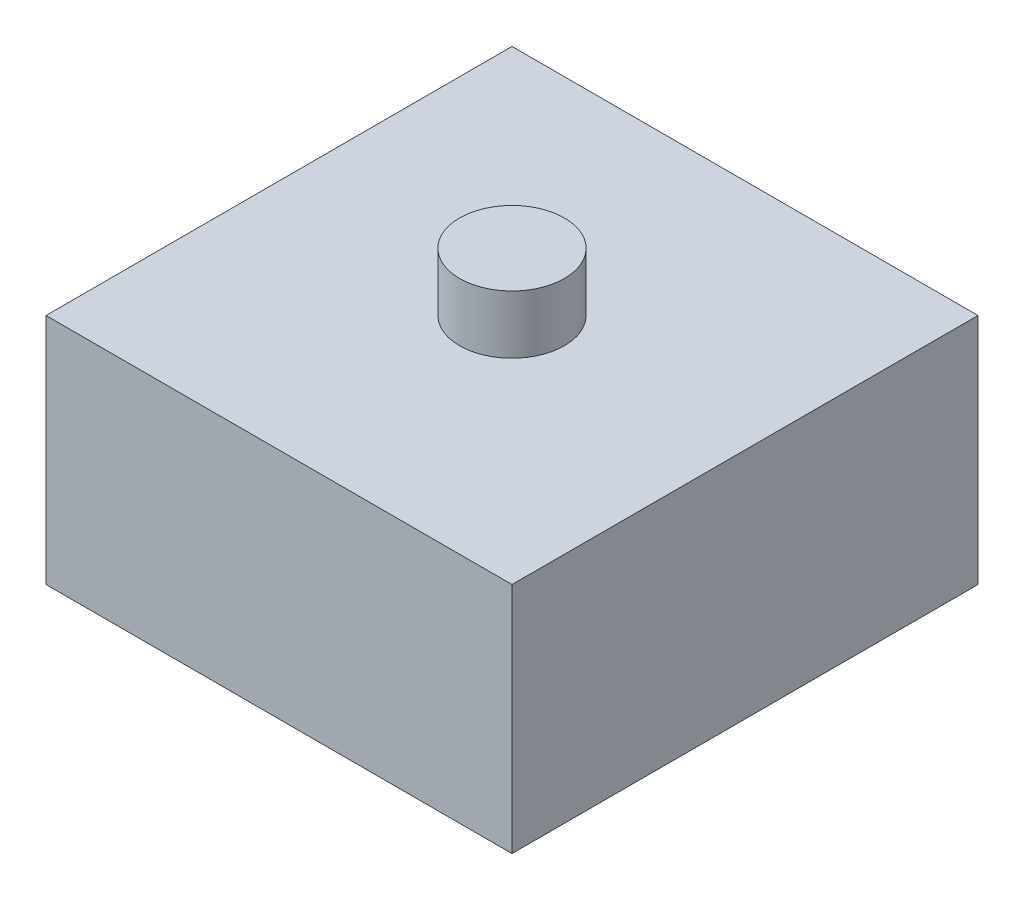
SolidWorks part; units mm, degrees
other "Marquage1"
sketch "Esquisse2" plane through (-153.8116, 62.4013, 250) normal (0, 1, 0) x (1, 0, 0)
ref_plane "Plan de face" through (0, 0, 0) normal (0, 0, 1) x (1, 0, 0)
ref_plane "Plan de dessus" through (0, 0, 0) normal (0, 1, 0) x (1, 0, 0)
ref_plane "Plan de droite" through (0, 0, 0) normal (1, 0, 0) x (0, 0, -1)
sketch "Esquisse1" plane through (0, 0, 0) normal (0, 0, 1) x (1, 0, 0)
  line L1 (-303.8116, 62.4013) -> (96.1884, 62.4013)
  line L2 (-303.8116, 62.4013) -> (-303.8116, -137.5987)
  line L3 (-303.8116, -137.5987) -> (96.1884, -137.5987)
  line L4 (96.1884, 62.4013) -> (96.1884, -137.5987)
  dimension "D1" = 400
  dimension "D2" = 200
extrude "Boss.-Extru.1" add sketch "Esquisse1" along normal blind 400 contours L2 L1 L4 L3
sketch "Esquisse3" plane through (0, 62.4013, 0) normal (0, 1, 0) x (1, 0, 0)
  line L0 (-103.8116, 0) -> (-103.8116, -400) construction
  line L1 (-303.8116, 0) -> (96.1884, 0) construction
  line L2 (-303.8116, -400) -> (96.1884, -400) construction
  circle A0 centre (-103.8116, -200) radius 45
extrude "Boss.-Extru.2" add sketch "Esquisse3" along normal blind 50 contours A0
